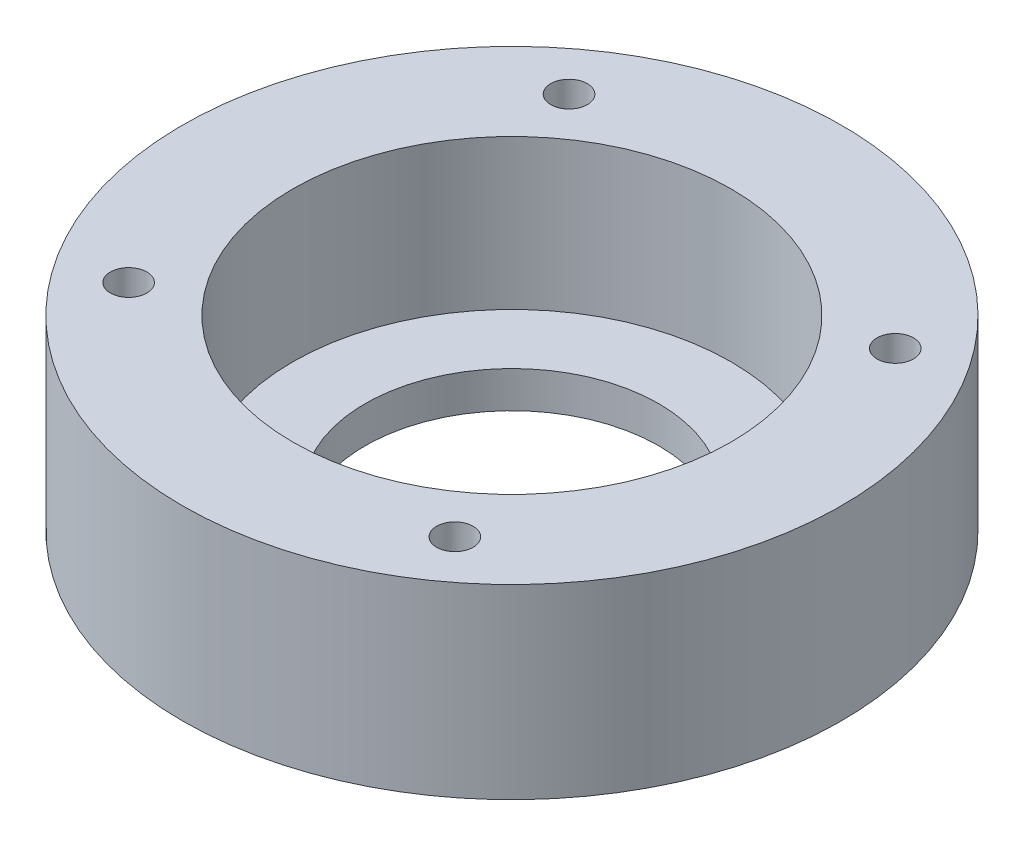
SolidWorks part; units mm, degrees
ref_plane "Plan de face" through (0, 0, 0) normal (0, 0, 1) x (1, 0, 0)
ref_plane "Plan de dessus" through (0, 0, 0) normal (0, 1, 0) x (1, 0, 0)
ref_plane "Plan de droite" through (0, 0, 0) normal (1, 0, 0) x (0, 0, -1)
sketch "Esquisse1" plane through (0, 0, 0) normal (0, 0, 1) x (1, 0, 0)
  line L0 (20.1, 0) -> (45.1, 0)
  line L1 (45.1, 0) -> (45.1, 25.5)
  line L2 (45.1, 25.5) -> (30, 25.5)
  line L3 (30, 25.5) -> (30, 5)
  line L4 (30, 5) -> (20.1, 5)
  line L5 (20.1, 5) -> (20.1, 0)
  line L6 (0, 77.6026) -> (0, -21.2432) construction
  dimension "D1" = 20.1
  dimension "D2" = 30
  dimension "D3" = 45.1
  dimension "D4" = 25.5
  dimension "D5" = 20.5
revolve "Révolution1" add sketch "Esquisse1" angle 360 about L6
hole_wizard "Trou taraudé M61" positions "Esquisse4" profile "Esquisse3" tap size "M6" standard "ISO"
sketch "Esquisse4" plane through (0, 0, 0) normal (0, -1, 0) x (1, 0, 0)
  circle A0 centre (0, 0) radius 37.5
  point P0 (-22.3218, -30.1329)
  dimension "D1" = 75
sketch "Esquisse3" plane through (-22.3218, 0, -30.1329) normal (1, 0, 0) x (0, 0, -1)
  line L0 (0, 0) -> (0, 25.5)
  line L1 (0, 25.5) -> (2.5, 25.5)
  line L2 (2.5, 25.5) -> (2.5, 0)
  line L5 (2.5, 0) -> (0, 0)
  line L11 (0, -6.35) -> (0, 107.95) construction
  dimension "Diamètre du trou pour taraudage jusqu'au prochain" = 5
  dimension "Profondeur du trou pour taraudage jusqu'au prochain" = 25.5
pattern_circular "Répétition circulaire1" count 4 every 90 about axis through (0, 0, 0) along (0, 1, 0) of "Trou taraudé M61"
